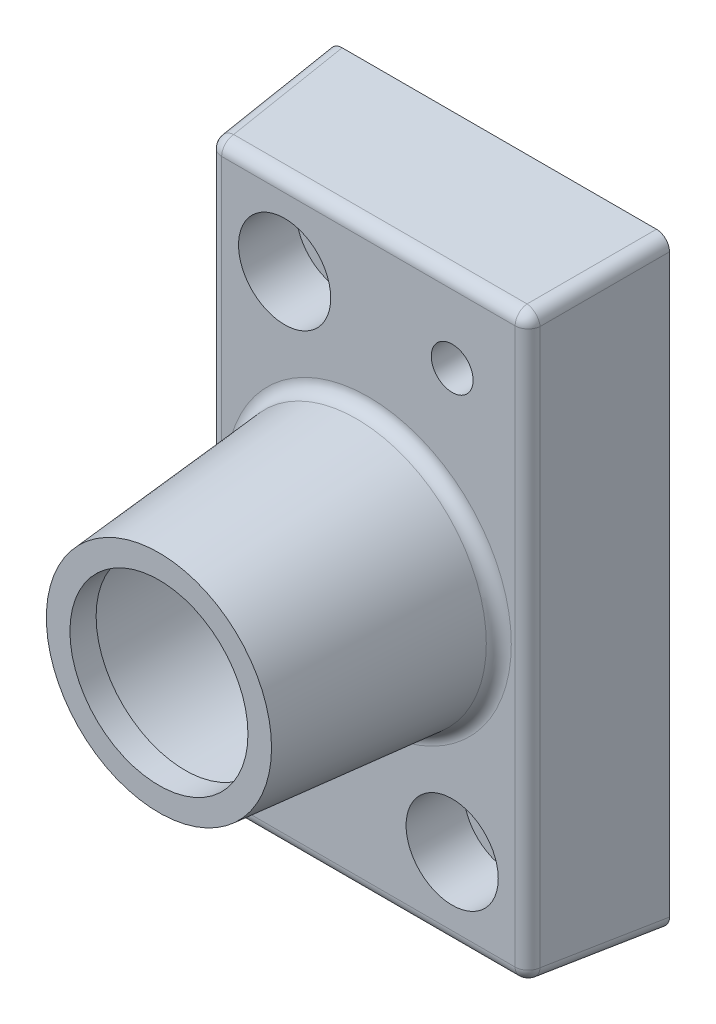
SolidWorks part; units mm, degrees
ref_plane "Frontal" through (0, 0, 0) normal (0, 0, 1) x (1, 0, 0)
ref_plane "Horizontal" through (0, 0, 0) normal (0, 1, 0) x (1, 0, 0)
ref_plane "Profil" through (0, 0, 0) normal (1, 0, 0) x (0, 0, -1)
sketch "Esquisse1" plane through (0, 0, 0) normal (0, 0, 1) x (1, 0, 0)
  line L1 (-32.5, 57.5) -> (32.5, 57.5)
  line L2 (-32.5, 57.5) -> (-32.5, -57.5)
  line L3 (-32.5, -57.5) -> (32.5, -57.5)
  line L4 (32.5, 57.5) -> (32.5, -57.5)
  point P7 (-32.5, -57.5)
  point P13 (32.5, 57.5)
  point P16 (-32.5, 57.5)
  dimension "D1" = 65
  dimension "D2" = 32.5
  dimension "D3" = 115
  dimension "D4" = 57.5
extrude "Base-Extrusion" add sketch "Esquisse1" along normal blind 25 draft 5
sketch "Esquisse2" plane through (0, 0, 25) normal (0, 0, 1) x (1, 0, 0)
  circle A0 centre (0, 0) radius 25
  dimension "D1" = 50
extrude "Boss.-Extru.1" add sketch "Esquisse2" along normal blind 40 draft 5
fillet "Congé1" radius 2.5
sketch "Esquisse3" plane through (0, 0, 0) normal (0, 0, -1) x (-1, 0, 0)
  circle A0 centre (0, 0) radius 20
  dimension "D1" = 40
extrude "Enlèv. mat.-Extru.1" cut sketch "Esquisse3" against normal blind 60
sketch "Esquisse4" plane through (0, 0, 65) normal (0, 0, 1) x (1, 0, 0)
  circle A0 centre (0, 0) radius 17
  dimension "D1" = 34
extrude "Enlèv. mat.-Extru.2" cut sketch "Esquisse4" against normal through all
hole_wizard "Perçage1" positions "Esquisse6" profile "Esquisse5" counterbore size "M10" standard "Ansi Métrique"
sketch "Esquisse6" plane through (0, 0, 25) normal (0, 0, 1) x (1, 0, 0)
  point P0 (16, -40)
  point P1 (-16, 40)
  dimension "D1" = 40
  dimension "D2" = 40
  dimension "D3" = 16
  dimension "D4" = 16
sketch "Esquisse5" plane through (16, -40, 25) normal (1, 0, 0) x (0, -1, 0)
  line L0 (0, 0) -> (0, 25)
  line L1 (0, 25) -> (5.5, 25)
  line L3 (5.5, 25) -> (5.5, 11)
  line L4 (5.5, 11) -> (8.8, 11)
  line L5 (8.8, 11) -> (8.8, 0)
  line L7 (8.8, 0) -> (0, 0)
  line L11 (0, -6.35) -> (0, 107.95) construction
  dimension "Diamètre du perçage jusqu'au prochain" = 11
  dimension "Profondeur du perçage jusqu'au prochain" = 25
  dimension "Diamètre du chambrage" = 17.6
  dimension "Profondeur du chambrage" = 11
sketch "Esquisse7" plane through (0, 0, 25) normal (0, 0, 1) x (1, 0, 0)
  circle A0 centre (16, 40) radius 4
  circle A1 centre (-16, -40) radius 4
  dimension "D1" = 8
  dimension "D2" = 16
  dimension "D3" = 40
  dimension "D4" = 80
  dimension "D5" = 32
extrude "Enlèv. mat.-Extru.3" cut sketch "Esquisse7" against normal through all
